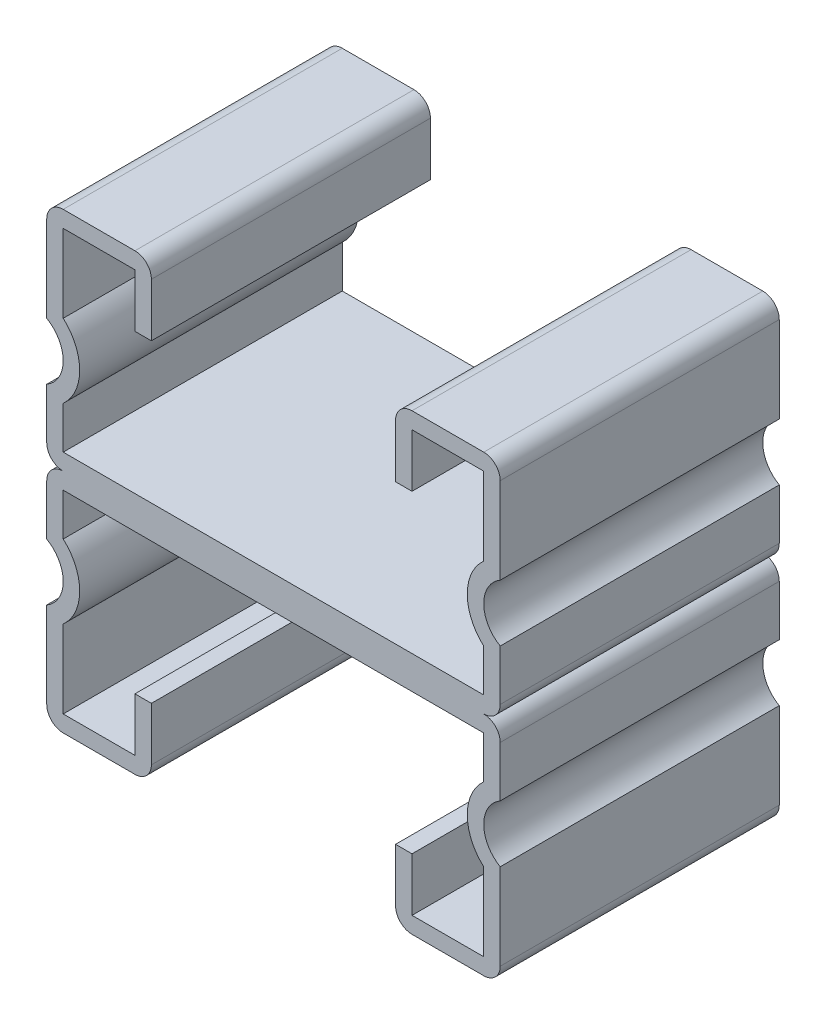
SolidWorks part; units mm, degrees
ref_plane "Plane1" through (0, 0, 0) normal (0, 0, 1) x (1, 0, 0)
ref_plane "Plane2" through (0, 0, 0) normal (0, 1, 0) x (1, 0, 0)
ref_plane "Plane3" through (0, 0, 0) normal (1, 0, 0) x (0, 0, -1)
sketch "Sketch1" plane through (0, 0, 0) normal (0, 0, 1) x (1, 0, 0)
  line L0 (-20.6375, 19.1389) -> (-20.6375, 11.2952)
  line L1 (-20.6375, 6.1038) -> (-20.6375, 1.4986)
  line L2 (-19.1389, 0) -> (19.1389, 0)
  line L3 (20.6375, 1.4986) -> (20.6375, 6.1038)
  line L4 (20.6375, 11.2952) -> (20.6375, 19.1389)
  line L5 (19.1389, 20.6375) -> (12.6111, 20.6375)
  line L6 (11.1125, 19.1389) -> (11.1125, 14.2875)
  line L7 (-19.1389, 20.6375) -> (-12.6111, 20.6375)
  line L8 (-11.1125, 19.1389) -> (-11.1125, 14.2875)
  line L9 (19.1389, 3.4236) -> (19.1389, 6.4516) construction
  line L10 (-19.1389, 15.1511) -> (-19.1389, 3.4236) construction
  line L11 (-12.6111, 19.1389) -> (-12.6111, 14.2875)
  line L12 (-19.1389, 19.1389) -> (-12.6111, 19.1389)
  line L13 (-19.1389, 19.1389) -> (-19.1389, 12.0505)
  line L14 (-19.1389, 5.3485) -> (-19.1389, 1.4986)
  line L15 (-19.1389, 1.4986) -> (19.1389, 1.4986)
  line L16 (19.1389, 1.4986) -> (19.1389, 5.3485)
  line L17 (19.1389, 12.0505) -> (19.1389, 19.1389)
  line L18 (19.1389, 19.1389) -> (12.6111, 19.1389)
  line L19 (12.6111, 19.1389) -> (12.6111, 14.2875)
  line L20 (-12.6111, 14.2875) -> (-11.1125, 14.2875)
  line L21 (11.1125, 14.2875) -> (12.6111, 14.2875)
  arc A0 (20.6375, 11.2952) -> (20.6375, 6.1038) centre (22.1361, 8.6995) ccw
  arc A1 (-20.6375, 6.1038) -> (-20.6375, 11.2952) centre (-22.1361, 8.6995) ccw
  arc A2 (-12.6111, 20.6375) -> (-11.1125, 19.1389) centre (-12.6111, 19.1389) cw
  arc A3 (-20.6375, 19.1389) -> (-19.1389, 20.6375) centre (-19.1389, 19.1389) cw
  arc A4 (-19.1389, 0) -> (-20.6375, 1.4986) centre (-19.1389, 1.4986) cw
  arc A5 (20.6375, 1.4986) -> (19.1389, 0) centre (19.1389, 1.4986) cw
  arc A6 (19.1389, 20.6375) -> (20.6375, 19.1389) centre (19.1389, 19.1389) cw
  arc A7 (11.1125, 19.1389) -> (12.6111, 20.6375) centre (12.6111, 19.1389) cw
  arc A8 (-19.1389, 5.3485) -> (-19.1389, 12.0505) centre (-22.1361, 8.6995) ccw
  arc A9 (19.1389, 12.0505) -> (19.1389, 5.3485) centre (22.1361, 8.6995) ccw
  dimension "D1" = 20.6375
  dimension "D9" = 2.9972
  dimension "D10" = 2.9972
  dimension "D2" = 8.6995
  dimension "Width" = 41.275
  dimension "D6" = 22.225
  dimension "edge" = 9.525
  dimension "Lip" = 6.35
  dimension "gauge" = 1.4986
extrude "Base-Extrude" add sketch "Sketch1" along normal mid plane 25.4
mirror "Mirror1" about plane through (0, 0, 0) normal (0, 1, 0) of "Base-Extrude"
equation "\"D1@Sketch1\" = \"Width@Sketch1\" / 2"
equation "\"D6@Sketch1\" = \"Width@Sketch1\" - 2 * \"edge@Sketch1\""
equation "\"D10@Sketch1\" = 2 * \"gauge@Sketch1\""
equation "\"D9@Sketch1\" = \"D10@Sketch1\""
